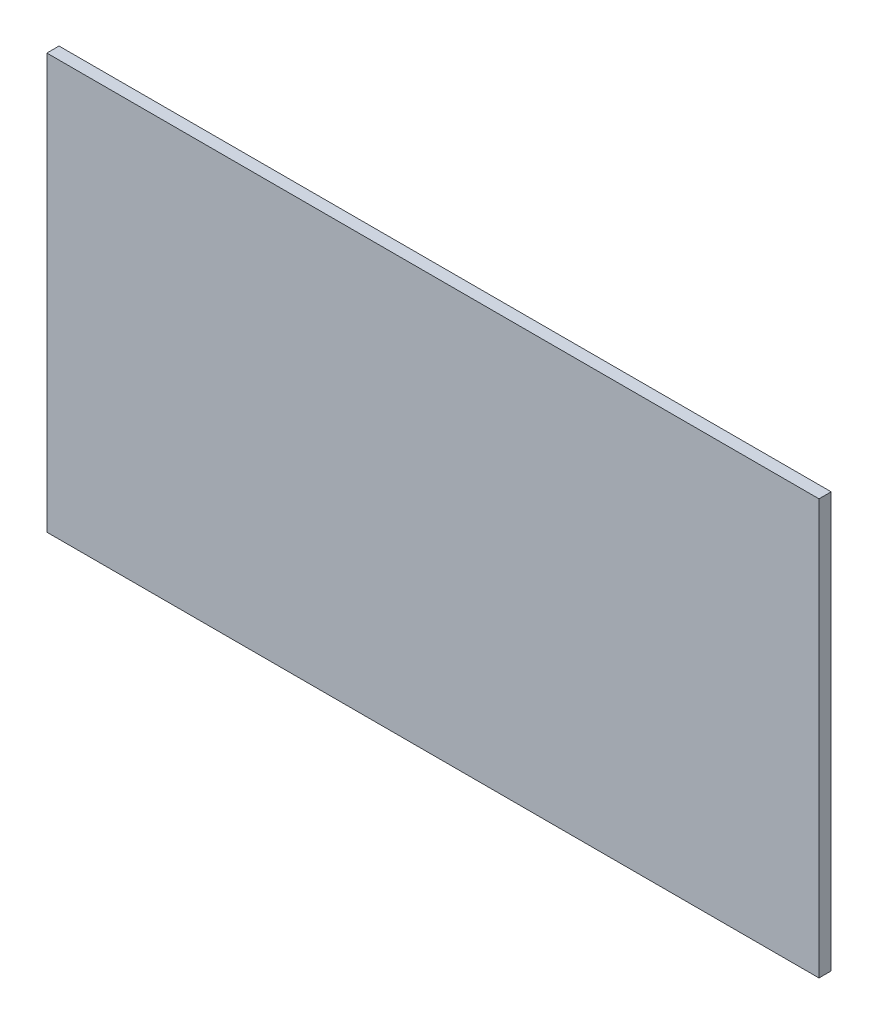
SolidWorks part; units mm, degrees
ref_plane "前视基准面" through (0, 0, 0) normal (0, 0, 1) x (1, 0, 0)
ref_plane "上视基准面" through (0, 0, 0) normal (0, 1, 0) x (1, 0, 0)
ref_plane "右视基准面" through (0, 0, 0) normal (1, 0, 0) x (0, 0, -1)
sketch "草图1" plane through (0, 0, 0) normal (0, 0, 1) x (1, 0, 0)
  line L1 (0, 0) -> (12.6911, 0)
  line L2 (0, 0) -> (0, 6.8209)
  line L3 (0, 6.8209) -> (12.6911, 6.8209)
  line L4 (12.6911, 0) -> (12.6911, 6.8209)
extrude "凸台-拉伸1" add sketch "草图1" along normal blind 0.2
sketch "草图2" plane through (0, 0, 0) normal (0, 0, 1) x (1, 0, 0)
sketch_block_instance "块13-2"
sketch_block "块13"
sketch_block_instance "块11-2"
sketch_block "块11"
sketch_block_instance "块14-2"
sketch_block "块14"
sketch_block_instance "块12-2"
sketch_block "块12"
